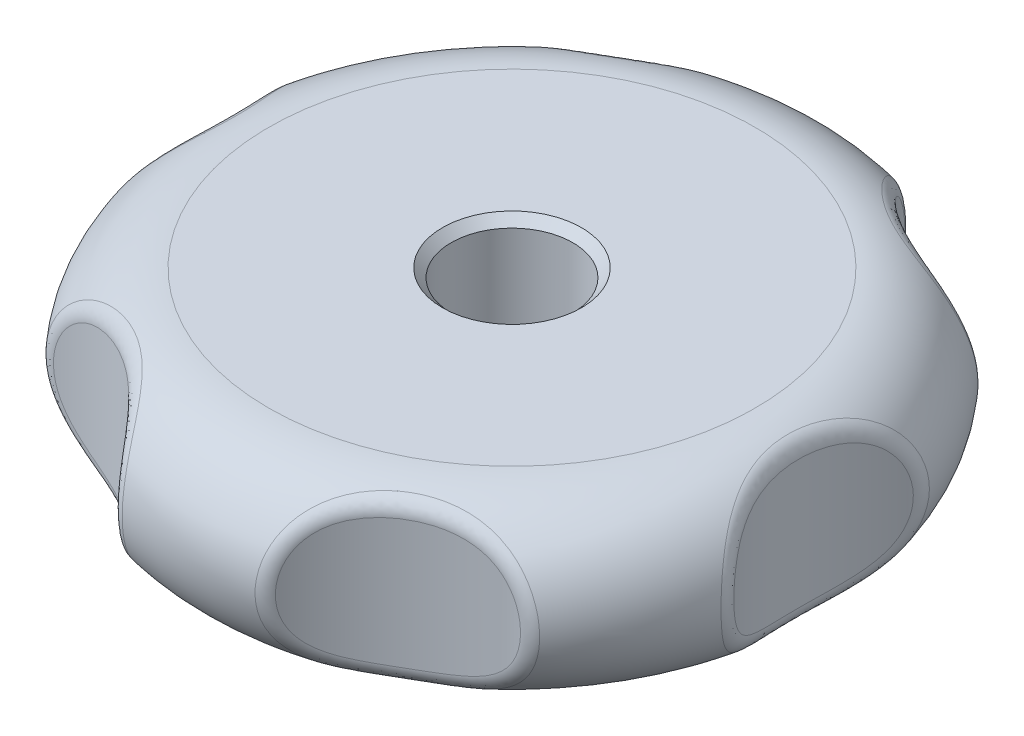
SolidWorks part; units mm, degrees
ref_plane "Спереди" through (0, 0, 0) normal (0, 0, 1) x (1, 0, 0)
ref_plane "Сверху" through (0, 0, 0) normal (0, 1, 0) x (1, 0, 0)
ref_plane "Справа" through (0, 0, 0) normal (1, 0, 0) x (0, 0, -1)
sketch "Эскиз4" plane through (0, 0, 0) normal (0, 0, 1) x (1, 0, 0)
  line L0 (0, 5) -> (0, -5) construction
  line L1 (-14, 5) -> (-3.5, 5)
  line L2 (-3.5, 5) -> (-3.5, -5)
  line L3 (-3.5, -5) -> (-14, -5)
  arc A0 (-14, 5) -> (-14, -5) centre (-14, 0) ccw
  dimension "D1" = 10
  dimension "D2" = 28
  dimension "D3" = 7
revolve "Повернуть2" add sketch "Эскиз4" angle 360 about L0
sketch "Эскиз1" plane through (0, 0, 0) normal (0, 1, 0) x (1, 0, 0)
  line L0 (0, 19) -> (0, 0) construction
  line L1 (0, 0) -> (13.25, 22.9497) construction
  line L2 (0, 0) -> (26.5, 0) construction
  arc A1 (4.2899, 18.5094) -> (-4.2899, 18.5094) centre (0, 0) ccw
  arc A2 (4.2899, 18.5094) -> (13.8846, 12.9698) centre (13.25, 22.9497) ccw
  circle A3 centre (0, 0) radius 26.5 construction
  arc A4 (18.1745, 5.5395) -> (18.1745, -5.5395) centre (26.5, 0) ccw
  arc A5 (13.8846, -12.9698) -> (4.2899, -18.5094) centre (13.25, -22.9497) ccw
  arc A6 (-4.2899, -18.5094) -> (-13.8846, -12.9698) centre (-13.25, -22.9497) ccw
  arc A7 (-18.1745, -5.5395) -> (-18.1745, 5.5395) centre (-26.5, 0) ccw
  arc A8 (-13.8846, 12.9698) -> (-4.2899, 18.5094) centre (-13.25, 22.9497) ccw
  arc A9 (-13.8846, 12.9698) -> (-18.1745, 5.5395) centre (0, 0) ccw
  arc A10 (-18.1745, -5.5395) -> (-13.8846, -12.9698) centre (0, 0) ccw
  arc A11 (-4.2899, -18.5094) -> (4.2899, -18.5094) centre (0, 0) ccw
  arc A12 (13.8846, -12.9698) -> (18.1745, -5.5395) centre (0, 0) ccw
  arc A13 (18.1745, 5.5395) -> (13.8846, 12.9698) centre (0, 0) ccw
  point P5 (-42.3302, 12.3926)
  dimension "D2" = 38
  dimension "D4" = 53
  dimension "D5" = 20
  dimension "D6" = 6
extrude "Вырез-Вытянуть1" cut sketch "Эскиз1" against normal mid plane 10 flip side to cut
fillet "Скругление1" radius 1 6 edges at (-4.8691, 2.775, 17.4943) (-17.5172, 2.9183, 4.3943) (11.0823, 3.8203, 13.1875) (16.9168, 3.8778, 2.8569) (-5.8269, 3.7891, -16.2491) (11.7565, 3.4972, -13.0618)
chamfer "Фаска1" distance 0.5 angle 45 2 edges at (0, -5, 3.5) (0, 5, 3.5)
